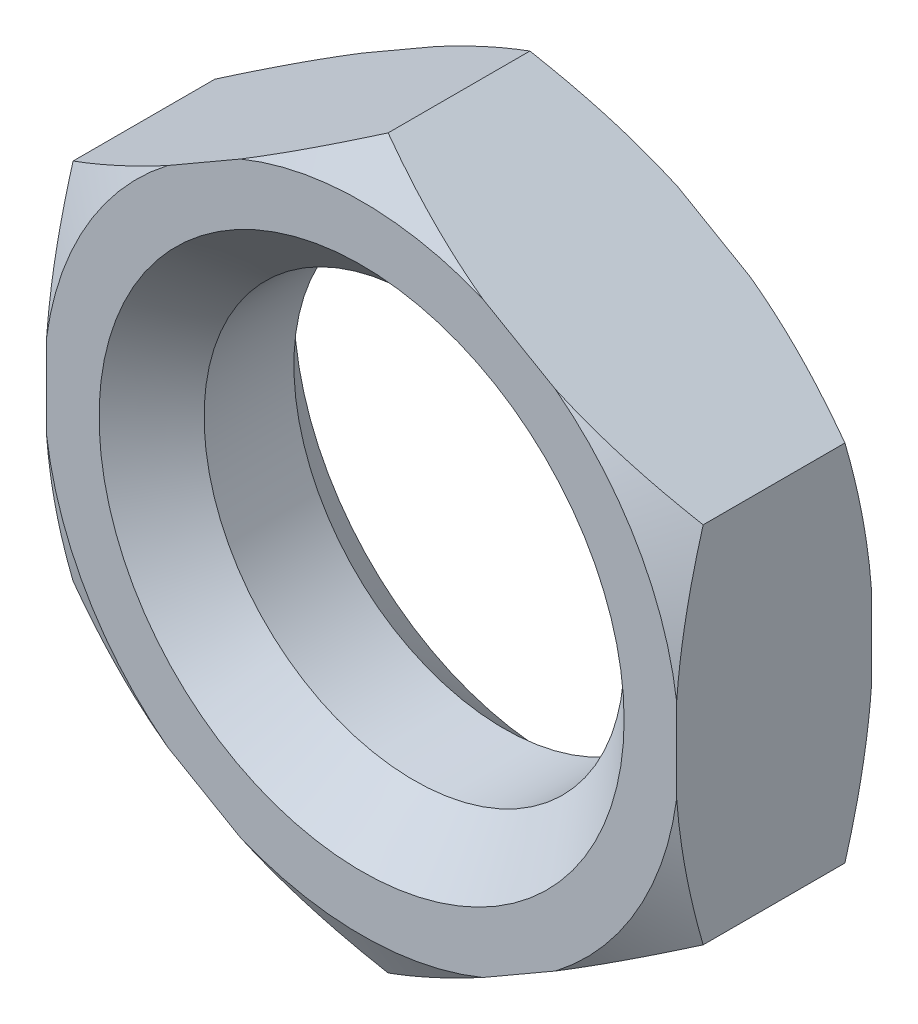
SolidWorks part; units mm, degrees
ref_plane "Front Plane" through (0, 0, 0) normal (0, 0, 1) x (1, 0, 0)
ref_plane "Top Plane" through (0, 0, 0) normal (0, 1, 0) x (1, 0, 0)
ref_plane "Right Plane" through (0, 0, 0) normal (1, 0, 0) x (0, 0, -1)
sketch "Sketch3" plane through (0, 0, 0) normal (0, 0, 1) x (1, 0, 0)
  line L1 (0, 13.8564) -> (-12, 6.9282)
  line L2 (-12, 6.9282) -> (-12, -6.9282)
  line L3 (-12, -6.9282) -> (0, -13.8564)
  line L4 (0, -13.8564) -> (12, -6.9282)
  line L5 (12, -6.9282) -> (12, 6.9282)
  line L6 (12, 6.9282) -> (0, 13.8564)
  circle A0 centre (0, 0) radius 12 construction
  dimension "D1" = 24
extrude "Boss-Extrude1" add sketch "Sketch3" along normal mid plane 7.42
sketch "Sketch4" plane through (0, 0, 0) normal (1, 0, 0) x (0, 0, -1)
  line L0 (-5.4578, 0) -> (6.1545, 0) construction
sketch "Sketch5" plane through (0, 0, 0) normal (1, 0, 0) x (0, 0, -1)
  line L0 (-3.71, 13.8564) -> (-3.71, 12.1064)
  line L1 (-3.71, 6.9282) -> (-3.71, 13.8564) construction
  line L2 (-3.71, 12.1064) -> (-2.6996, 13.8564)
  line L3 (-3.71, 13.8564) -> (3.71, 13.8564) construction
  line L4 (-2.6996, 13.8564) -> (-3.71, 13.8564)
  dimension "D1" = 1.75
  dimension "D2" = 30
revolve "Cut-Revolve1" cut sketch "Sketch5" angle 360 about L0
mirror "Mirror1" about plane through (0, 0, 0) normal (0, 0, 1) of "Cut-Revolve1"
sketch "Sketch6" plane through (0, 0, 3.71) normal (0, 0, 1) x (1, 0, 0)
  circle A0 centre (0, 0) radius 8
  dimension "D1" = 16
extrude "Cut-Extrude1" cut sketch "Sketch6" against normal blind 7.42
chamfer "Chamfer1" distance 2 angle 45 2 edges at (8, 0, -3.71) (8, 0, 3.71)
